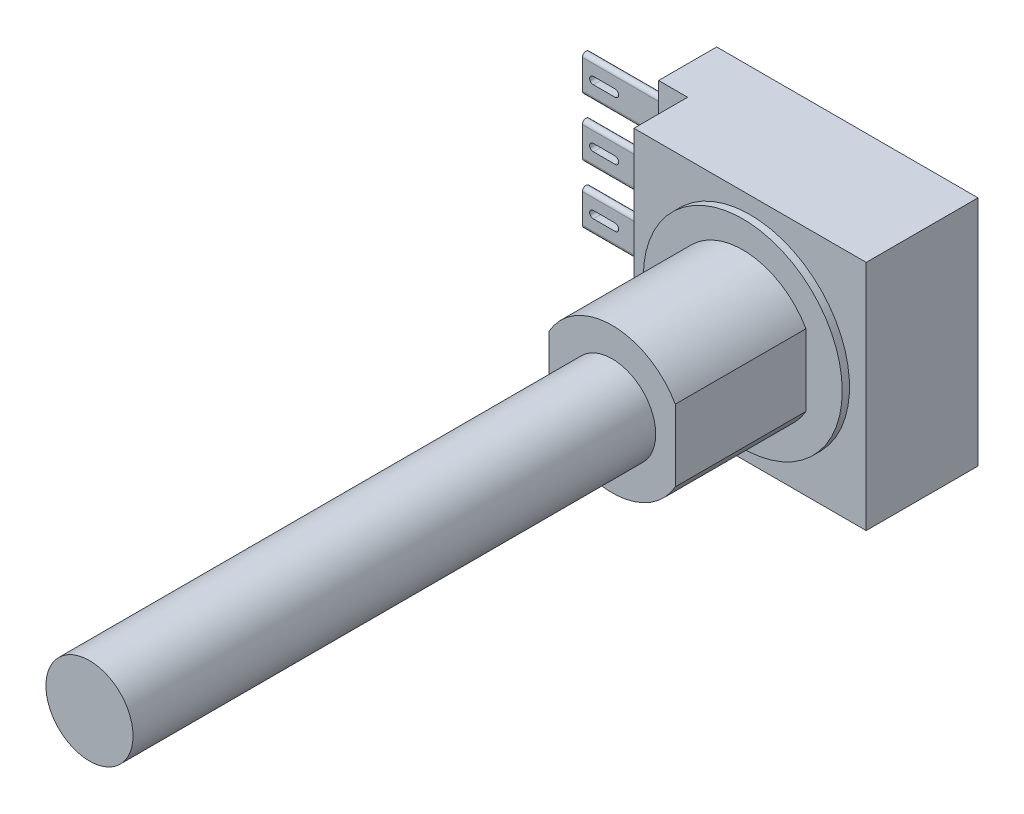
SolidWorks part; units mm, degrees
ref_plane "Přední rovina" through (0, 0, 0) normal (0, 0, 1) x (1, 0, 0)
ref_plane "Horní rovina" through (0, 0, 0) normal (0, 1, 0) x (1, 0, 0)
ref_plane "Pravá rovina" through (0, 0, 0) normal (1, 0, 0) x (0, 0, -1)
sketch "Skica1" plane through (0, 0, 0) normal (0, 0, 1) x (1, 0, 0)
  line L1 (-20.8042, 3.1755) -> (-2.8042, 3.1755)
  line L2 (-20.8042, 3.1755) -> (-20.8042, -12.8245)
  line L3 (-20.8042, -12.8245) -> (-2.8042, -12.8245)
  line L4 (-2.8042, 3.1755) -> (-2.8042, -12.8245)
  dimension "D1" = 16
  dimension "D2" = 18
extrude "Přidat vysunutím1" add sketch "Skica1" along normal blind 4
sketch "Skica2" plane through (0, 0, 4) normal (0, 0, 1) x (1, 0, 0)
  line L0 (-2.8042, 3.1755) -> (-20.8042, 3.1755) construction
  line L1 (-2.8042, 3.1755) -> (-18.8042, 3.1755)
  line L2 (-2.8042, 3.1755) -> (-2.8042, -12.8245)
  line L3 (-2.8042, -12.8245) -> (-18.8042, -12.8245)
  line L4 (-18.8042, 3.1755) -> (-18.8042, -12.8245)
  line L5 (-20.8042, -12.8245) -> (-2.8042, -12.8245) construction
  line L6 (-2.8042, -12.8245) -> (-2.8042, 3.1755) construction
  dimension "D1" = 16
  dimension "D2" = 16
extrude "Přidat vysunutím2" add sketch "Skica2" along normal blind 3.7
sketch "Skica3" plane through (0, 0, 7.7) normal (0, 0, 1) x (1, 0, 0)
  line L0 (-18.8042, -4.8245) -> (-2.8042, -4.8245) construction
  line L1 (-18.8042, 3.1755) -> (-18.8042, -12.8245) construction
  line L2 (-2.8042, -12.8245) -> (-2.8042, 3.1755) construction
  line L3 (-10.8042, 3.1755) -> (-10.8042, -12.8245) construction
  line L4 (-2.8042, 3.1755) -> (-18.8042, 3.1755) construction
  line L5 (-18.8042, -12.8245) -> (-2.8042, -12.8245) construction
  circle A0 centre (-10.8042, -4.8245) radius 6.85
extrude "Přidat vysunutím3" add sketch "Skica3" along normal blind 0.5
sketch "Skica4" plane through (0, 0, 8.2) normal (0, 0, 1) x (1, 0, 0)
  circle A0 centre (-10.8042, -4.8245) radius 5
  circle A1 centre (-10.8042, -4.8245) radius 6.85 construction
extrude "Přidat vysunutím4" add sketch "Skica4" along normal blind 9
sketch "Skica5" plane through (0, 0, 17.2) normal (0, 0, 1) x (1, 0, 0)
  circle A0 centre (-10.8042, -4.8245) radius 3
  circle A1 centre (-10.8042, -4.8245) radius 5 construction
extrude "Přidat vysunutím5" add sketch "Skica5" along normal blind 36
sketch "Skica6" plane through (0, 0, 17.2) normal (0, 0, 1) x (1, 0, 0)
  line L0 (-15.1542, 0.6755) -> (-6.4542, -10.3245) construction
  line L1 (-15.1542, 0.6755) -> (-6.4542, 0.6755)
  line L2 (-15.1542, 0.6755) -> (-15.1542, -10.3245)
  line L3 (-15.1542, -10.3245) -> (-6.4542, -10.3245)
  line L4 (-6.4542, 0.6755) -> (-6.4542, -10.3245)
  line L5 (-6.4542, -10.3245) -> (-6.4181, -10.3426) construction
  line L6 (-6.4542, 0.6755) -> (-15.1542, -10.3245) construction
  line L7 (-10.8042, 0.1755) -> (-10.8042, -9.8245) construction
  line L8 (-5.8042, -4.8245) -> (-15.8042, -4.8245) construction
  circle A1 centre (-10.8042, -4.8245) radius 5 construction
  circle A2 centre (-10.8042, -4.8245) radius 5 construction
  point P14 (-10.8042, -4.8245)
  point P15 (-10.8042, -4.8245)
  dimension "D1" = 8.7
  dimension "D2" = 11
extrude "Odebrat vysunutím2" cut sketch "Skica6" against normal up to surface (9 mm away) flip side to cut
sketch "Skica7" plane through (-20.8042, 0, 0) normal (-1, 0, 0) x (0, 0, 1)
  line L0 (2, 3.1755) -> (2, -12.7089) construction
  line L1 (4, 3.1755) -> (0, 3.1755) construction
  line L2 (4, -4.8245) -> (0, -4.8245) construction
  line L3 (4, 3.1755) -> (4, -12.8245) construction
  line L4 (0, 3.1755) -> (0, -12.8245) construction
  line L5 (2, -3.8245) -> (2, -5.8245) construction
  line L6 (2.25, -3.8245) -> (2.25, -5.8245)
  line L7 (1.75, -3.8245) -> (1.75, -5.8245)
  line L8 (4, 3.1755) -> (0, -4.8245) construction
  line L9 (0, -4.8245) -> (0, 3.1755) construction
  line L10 (0, 3.1755) -> (4, -4.8245) construction
  line L11 (4, -4.8245) -> (0, -12.8245) construction
  line L12 (2, 0.1755) -> (2, -1.8245) construction
  line L13 (2.25, 0.1755) -> (2.25, -1.8245)
  line L14 (1.75, 0.1755) -> (1.75, -1.8245)
  line L15 (2, -7.8245) -> (2, -9.8245) construction
  line L16 (2.25, -7.8245) -> (2.25, -9.8245)
  line L17 (1.75, -7.8245) -> (1.75, -9.8245)
  arc A0 (2.25, -3.8245) -> (1.75, -3.8245) centre (2, -3.8245) ccw
  arc A1 (1.75, -5.8245) -> (2.25, -5.8245) centre (2, -5.8245) ccw
  arc A2 (2.25, 0.1755) -> (1.75, 0.1755) centre (2, 0.1755) ccw
  arc A3 (1.75, -1.8245) -> (2.25, -1.8245) centre (2, -1.8245) ccw
  arc A4 (2.25, -7.8245) -> (1.75, -7.8245) centre (2, -7.8245) ccw
  arc A5 (1.75, -9.8245) -> (2.25, -9.8245) centre (2, -9.8245) ccw
  point P10 (2, -4.8245)
  point P13 (2, -4.8245)
  point P19 (2, -8.8245)
  point P25 (2, -0.8245)
  point P28 (2, -0.8245)
  point P35 (2, -8.8245)
  dimension "D1" = 2
  dimension "D2" = 0.5
extrude "Přidat vysunutím6" add sketch "Skica7" along normal blind 7
sketch "Skica8" plane through (0, 0, 2.25) normal (0, 0, 1) x (1, 0, 0)
  line L0 (-27.8042, -4.8245) -> (-20.8042, -4.8245) construction
  line L1 (-27.8042, -5.8245) -> (-27.8042, -3.8245) construction
  line L2 (-20.8042, 3.1755) -> (-20.8042, -12.8245) construction
  line L3 (-27.052, -4.8245) -> (-25.552, -4.8245) construction
  line L4 (-27.052, -4.5745) -> (-25.552, -4.5745)
  line L5 (-27.052, -5.0745) -> (-25.552, -5.0745)
  line L6 (-27.8042, -0.8245) -> (-20.8042, -0.8245) construction
  line L7 (-27.8042, -1.8245) -> (-27.8042, 0.1755) construction
  line L8 (-27.8042, -8.8245) -> (-20.8042, -8.8245) construction
  line L9 (-27.8042, -9.8245) -> (-27.8042, -7.8245) construction
  line L10 (-20.8042, -9.8245) -> (-20.8042, -7.8245) construction
  line L11 (-27.0542, -0.8245) -> (-25.5542, -0.8245) construction
  line L12 (-27.0542, -0.5745) -> (-25.5542, -0.5745)
  line L13 (-27.0542, -1.0745) -> (-25.5542, -1.0745)
  line L14 (-27.0542, -8.8245) -> (-25.5542, -8.8245) construction
  line L15 (-27.0542, -8.5745) -> (-25.5542, -8.5745)
  line L16 (-27.0542, -9.0745) -> (-25.5542, -9.0745)
  arc A0 (-27.052, -4.5745) -> (-27.052, -5.0745) centre (-27.052, -4.8245) ccw
  arc A1 (-25.552, -5.0745) -> (-25.552, -4.5745) centre (-25.552, -4.8245) ccw
  arc A2 (-27.0542, -0.5745) -> (-27.0542, -1.0745) centre (-27.0542, -0.8245) ccw
  arc A3 (-25.5542, -1.0745) -> (-25.5542, -0.5745) centre (-25.5542, -0.8245) ccw
  arc A4 (-27.0542, -8.5745) -> (-27.0542, -9.0745) centre (-27.0542, -8.8245) ccw
  arc A5 (-25.5542, -9.0745) -> (-25.5542, -8.5745) centre (-25.5542, -8.8245) ccw
  point P8 (-26.302, -4.8245)
  point P25 (-26.3042, -0.8245)
  point P32 (-26.3042, -8.8245)
  dimension "D1" = 0.5
  dimension "D2" = 1.5
  dimension "D3" = 0.7523
  dimension "D4" = 0.75
  dimension "D5" = 0.75
extrude "Odebrat vysunutím3" cut sketch "Skica8" against normal through all
